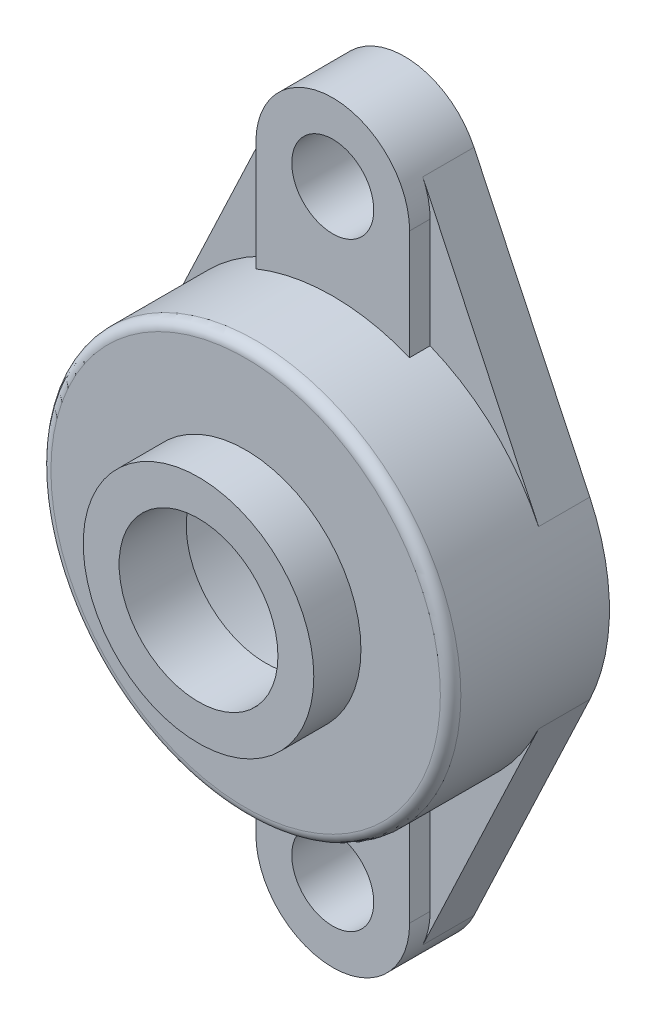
SolidWorks part; units mm, degrees
ref_plane "Plan1" through (0, 0, 0) normal (0, 0, 1) x (1, 0, 0)
ref_plane "Plan2" through (0, 0, 0) normal (0, 1, 0) x (1, 0, 0)
ref_plane "Plan3" through (0, 0, 0) normal (1, 0, 0) x (0, 0, -1)
sketch "Esquisse1" plane through (0, 0, 0) normal (0, 0, 1) x (1, 0, 0)
  line L0 (-59, 0) -> (43, 0) construction
  line L1 (0, 85) -> (0, -87) construction
  line L2 (-36.1634, 17.094) -> (-13.5613, 64.9103)
  line L3 (36.1634, 17.094) -> (13.5613, 64.9103)
  line L4 (36.1634, -17.094) -> (13.5613, -64.9103)
  line L5 (-36.1634, -17.094) -> (-13.5613, -64.9103)
  arc A1 (-36.1634, -17.094) -> (-36.1634, 17.094) centre (0, 0) cw
  arc A2 (-13.5613, 64.9103) -> (13.5613, 64.9103) centre (0, 58.5) cw
  arc A3 (36.1634, -17.094) -> (36.1634, 17.094) centre (0, 0) ccw
  arc A4 (-13.5613, -64.9103) -> (13.5613, -64.9103) centre (0, -58.5) ccw
  dimension "D1" = 15
  dimension "D2" = 80
  dimension "D3" = 117
extrude "Base-Extrusion" add sketch "Esquisse1" along normal blind 10
sketch "Esquisse2" plane through (0, 0, 10) normal (0, 0, 1) x (1, 0, 0)
  circle A0 centre (0, 0) radius 40
  arc A1 (36.1634, -17.094) -> (36.1634, 17.094) centre (0, 0) ccw construction
extrude "Boss.-Extru.1" add sketch "Esquisse2" along normal blind 21
sketch "Esquisse3" plane through (0, 0, 31) normal (0, 0, 1) x (1, 0, 0)
  circle A0 centre (0, 0) radius 22.5
  dimension "D1" = 45
extrude "Boss.-Extru.2" add sketch "Esquisse3" along normal blind 9.2
sketch "Esquisse5" plane through (0, 0, 10) normal (0, 0, 1) x (1, 0, 0)
  line L0 (15, 58.5) -> (15, -58.5)
  line L1 (-15, 58.5) -> (-15, -58.5)
  line L2 (-21, 0) -> (22.5, 0) construction
  arc A0 (13.5613, 64.9103) -> (-13.5613, 64.9103) centre (0, 58.5) ccw construction
  arc A1 (15, 58.5) -> (-15, 58.5) centre (0, 58.5) ccw
  circle A2 centre (0, 0) radius 22.5 construction
  arc A3 (15, -58.5) -> (-15, -58.5) centre (0, -58.5) cw
  point P3 (15, 0)
  point P15 (-15, 0)
extrude "Boss.-Extru.3" add sketch "Esquisse5" along normal blind 4
sketch "Esquisse4" plane through (0, 0, 40.2) normal (0, 0, 1) x (1, 0, 0)
  circle A0 centre (0, 0) radius 15.5
  dimension "D1" = 31
extrude "Enlèv. mat.-Extru.1" cut sketch "Esquisse4" against normal through all
sketch "Esquisse6" plane through (0, 0, 0) normal (0, 0, -1) x (-1, 0, 0)
  circle A0 centre (0, 0) radius 36
  dimension "D1" = 72
extrude "Enlèv. mat.-Extru.2" cut sketch "Esquisse6" against normal blind 2.1
sketch "Esquisse8" plane through (0, 0, 0) normal (0, 0, -1) x (-1, 0, 0)
  circle A0 centre (0, 58.5) radius 8
  circle A1 centre (0, -58.5) radius 8
  dimension "D1" = 16
extrude "Enlèv. mat.-Extru.3" cut sketch "Esquisse8" against normal through all
fillet "Congé1" radius 2 1 edges at (40, 0, 31)
sketch "Esquisse9" plane through (0, 0, 2.1) normal (0, 0, -1) x (-1, 0, 0)
  circle A0 centre (0, 0) radius 31
  dimension "D1" = 62
extrude "Enlèv. mat.-Extru.4" cut sketch "Esquisse9" against normal blind 24
sketch "Esquisse10" plane through (0, 0, 26.1) normal (0, 0, -1) x (-1, 0, 0)
  circle A0 centre (0, 0) radius 25
  dimension "D1" = 50
extrude "Enlèv. mat.-Extru.5" cut sketch "Esquisse10" against normal blind 1
